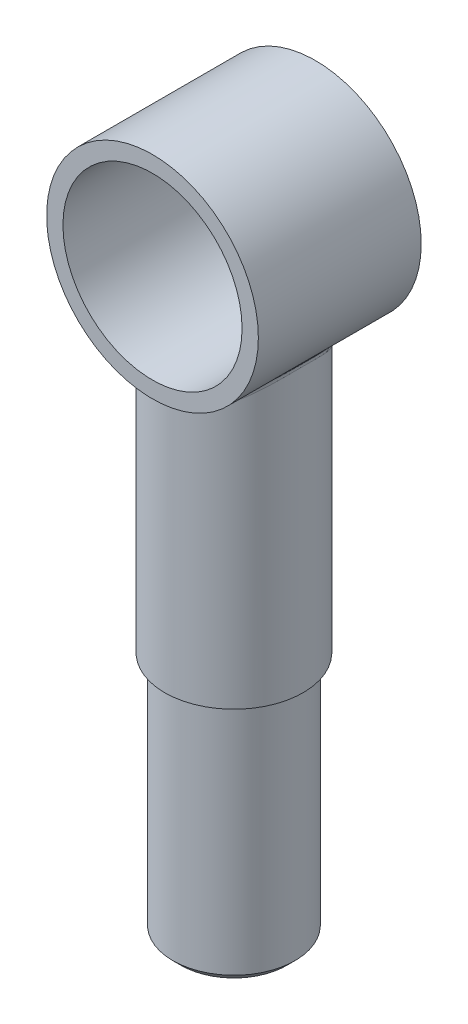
SolidWorks part; units mm, degrees
ref_plane "Plan1" through (0, 0, 0) normal (0, 0, 1) x (1, 0, 0)
ref_plane "Plan2" through (0, 0, 0) normal (0, 1, 0) x (1, 0, 0)
ref_plane "Plan3" through (0, 0, 0) normal (1, 0, 0) x (0, 0, -1)
sketch "Esquisse1" plane through (0, 0, 0) normal (0, 0, 1) x (1, 0, 0)
  circle A0 centre (0, 0) radius 13
  dimension "D1" = 26
extrude "Base-Extrusion" add sketch "Esquisse1" along normal mid plane 20
sketch "Esquisse2" plane through (0, 0, 0) normal (0, 1, 0) x (1, 0, 0)
  circle A0 centre (0, 0) radius 8.5
  dimension "D1" = 17
extrude "Boss.-Extru.1" add sketch "Esquisse2" against normal blind 45
fillet "Congé1" radius 1 1 edges at (-1.3124, -12.9336, -8.3981)
sketch "Esquisse5" plane through (0, 0, 0) normal (0, 1, 0) x (1, 0, 0)
  circle A0 centre (0, 0) radius 7.5
  dimension "D1" = 15
extrude "Boss.-Extru.2" add sketch "Esquisse5" against normal blind 75
sketch "Esquisse3" plane through (0, 0, 10) normal (0, 0, 1) x (1, 0, 0)
  circle A0 centre (0, 0) radius 11
  dimension "D1" = 22
extrude "Enlèv. mat.-Extru.1" cut sketch "Esquisse3" against normal through all
chamfer "Chanfrein1" distance 1 angle 45 1 edges at (0, -75, 7.5)
